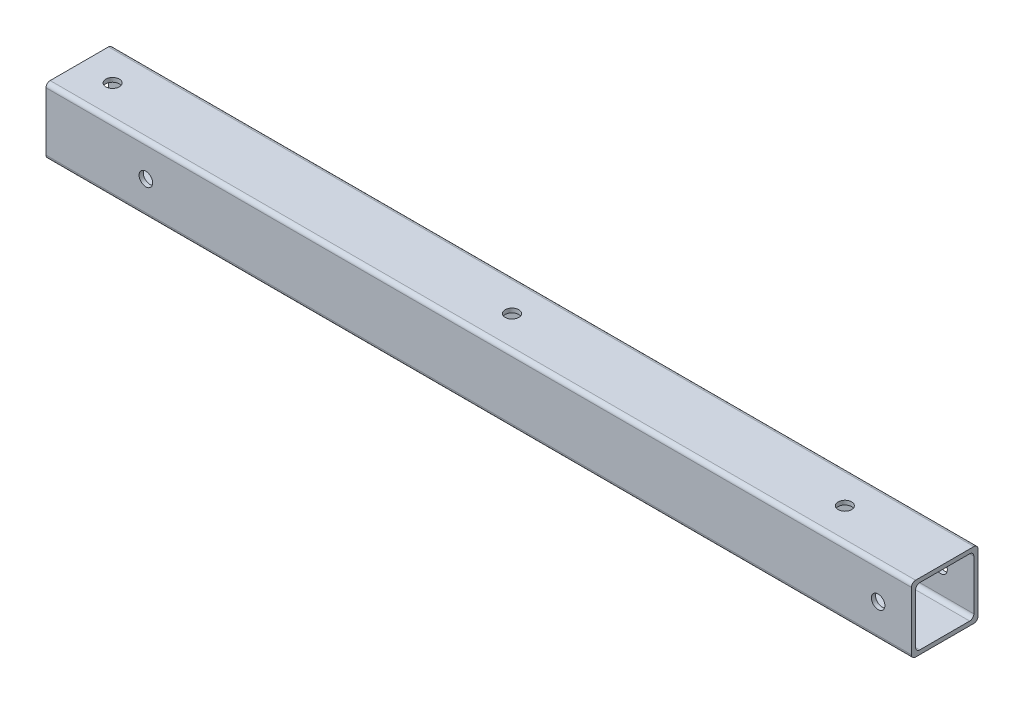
SolidWorks part; units mm, degrees
ref_plane "Front Plane" through (0, 0, 0) normal (0, 0, 1) x (1, 0, 0)
ref_plane "Top Plane" through (0, 0, 0) normal (0, 1, 0) x (1, 0, 0)
ref_plane "Right Plane" through (0, 0, 0) normal (1, 0, 0) x (0, 0, -1)
sketch "Sketch1" plane through (0, 0, 0) normal (0, 1, 0) x (1, 0, 0)
  line L1 (0, 0) -> (-1320.8, 0)
  line L2 (0, 0) -> (0, -101.6)
  line L3 (0, -101.6) -> (-1320.8, -101.6)
  line L4 (-1320.8, 0) -> (-1320.8, -101.6)
  dimension "D1" = 1320.8
  dimension "D2" = 101.6
extrude "Extrude1" add sketch "Sketch1" along normal blind 101.6
sketch "Sketch2" plane through (-1320.8, 0, 0) normal (-1, 0, 0) x (0, 0, 1)
  line L0 (0, 101.6) -> (101.6, 101.6) construction
  line L1 (6.35, 95.25) -> (95.25, 95.25)
  line L2 (6.35, 95.25) -> (6.35, 6.35)
  line L3 (6.35, 6.35) -> (95.25, 6.35)
  line L4 (95.25, 95.25) -> (95.25, 6.35)
  line L5 (0, 0) -> (101.6, 0) construction
  line L6 (101.6, 101.6) -> (101.6, 0) construction
  line L7 (0, 101.6) -> (0, 0) construction
  dimension "D1" = 6.35
  dimension "D2" = 6.35
  dimension "D3" = 6.35
  dimension "D4" = 6.35
extrude "Cut-Extrude1" cut sketch "Sketch2" against normal up to next
fillet "Fillet1" radius 6.35 8 edges at (-660.4, 6.35, 95.25) (-660.4, 0, 101.6) (-660.4, 101.6, 101.6) (-660.4, 95.25, 95.25) (-660.4, 95.25, 6.35) (-660.4, 101.6, 0) (-660.4, 6.35, 6.35) (-660.4, 0, 0)
sketch "Sketch3" plane through (0, 101.6, 0) normal (0, 1, 0) x (1, 0, 0)
  line L0 (0, -95.25) -> (0, -6.35) construction
  line L1 (0, -6.35) -> (-1320.8, -6.35) construction
  circle A0 centre (-1270, -50.8) radius 10.3188
  dimension "D1" = 20.6375
  dimension "D2" = 1270
  dimension "D3" = 44.45
extrude "Cut-Extrude2" cut sketch "Sketch3" against normal blind 101.6
sketch "Sketch4" plane through (0, 0, 101.6) normal (0, 0, 1) x (1, 0, 0)
  line L0 (0, 95.25) -> (0, 6.35) construction
  line L1 (0, 95.25) -> (-1320.8, 95.25) construction
  circle A0 centre (-1168.4, 50.8) radius 10.3188
  dimension "D1" = 20.6375
  dimension "D2" = 1168.4
  dimension "D3" = 44.45
extrude "Cut-Extrude3" cut sketch "Sketch4" against normal blind 101.6
sketch "Sketch5" plane through (0, 0, 101.6) normal (0, 0, 1) x (1, 0, 0)
  line L0 (0, 95.25) -> (0, 6.35) construction
  line L1 (0, 95.25) -> (-1320.8, 95.25) construction
  circle A0 centre (-50.8, 50.8) radius 10.3188
  dimension "D1" = 20.6375
  dimension "D2" = 50.8
  dimension "D3" = 44.45
extrude "Cut-Extrude4" cut sketch "Sketch5" against normal blind 101.6
sketch "Sketch6" plane through (0, 101.6, 0) normal (0, 1, 0) x (1, 0, 0)
  line L0 (0, -95.25) -> (0, -6.35) construction
  line L1 (0, -6.35) -> (-1320.8, -6.35) construction
  circle A0 centre (-152.4, -50.8) radius 10.3187
  dimension "D1" = 20.6375
  dimension "D2" = 152.4
  dimension "D3" = 44.45
extrude "Cut-Extrude5" cut sketch "Sketch6" against normal blind 101.6
sketch "Sketch8" plane through (0, 0, 0) normal (0, -1, 0) x (1, 0, 0)
  line L0 (0, 95.25) -> (0, 6.35) construction
  line L1 (-1320.8, 6.35) -> (0, 6.35) construction
  circle A0 centre (-660.4, 50.8) radius 10.3188
  dimension "D1" = 20.6375
  dimension "D2" = 660.4
  dimension "D3" = 44.45
extrude "Cut-Extrude7" cut sketch "Sketch8" against normal through all
